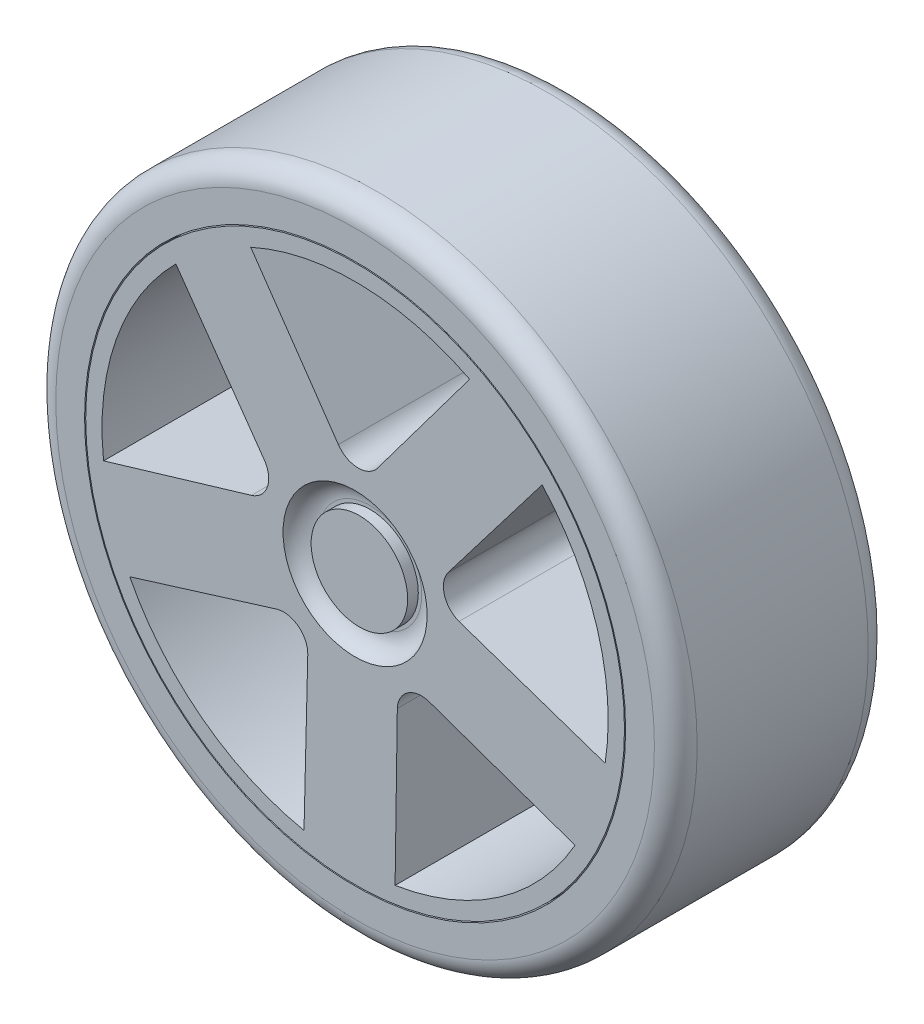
SolidWorks part; units mm, degrees
ref_plane "Front Plane" through (0, 0, 0) normal (0, 0, 1) x (1, 0, 0)
ref_plane "Top Plane" through (0, 0, 0) normal (0, 1, 0) x (1, 0, 0)
ref_plane "Right Plane" through (0, 0, 0) normal (1, 0, 0) x (0, 0, -1)
sketch "Sketch2" plane through (0, 0, 0) normal (0, 0, 1) x (1, 0, 0)
  circle A0 centre (0, 0) radius 38.1
  dimension "D1" = 76.2
extrude "Boss-Extrude1" add sketch "Sketch2" along normal blind 25.4
fillet "Fillet1" radius 2.54 2 edges at (38.1, 0, 0) (38.1, 0, 25.4)
sketch "Sketch3" plane through (0, 0, 25.4) normal (0, 0, 1) x (1, 0, 0)
  circle A0 centre (0, 0) radius 32.1386
extrude "Cut-Extrude1" cut sketch "Sketch3" against normal blind 25.4
sketch "Sketch4" plane through (0, 0, 0) normal (0, 0, 1) x (1, 0, 0)
  circle A0 centre (0, 0) radius 32.1386
sketch "Sketch6" plane through (0, 0, 0) normal (0, 0, 1) x (1, 0, 0)
  circle A0 centre (0, 0) radius 32.004
  dimension "D1" = 64.008
extrude "Boss-Extrude3" add sketch "Sketch6" along normal blind 25.4 separate body
sketch "Sketch7" plane through (0, 0, 25.4) normal (0, 0, 1) x (1, 0, 0)
  line L0 (-12.399, 27.3907) -> (-1.986, 12.2961)
  line L1 (2.6156, 12.1323) -> (13.6069, 26.8112)
  line L2 (12.3468, 1.2615) -> (29.7037, -4.6559)
  line L3 (22.2186, 20.2563) -> (11.0806, 5.6885)
  line L4 (5.0152, -11.3526) -> (4.751, -29.6886)
  line L5 (26.1309, -14.8716) -> (8.8342, -8.7804)
  line L6 (-9.2472, -8.2779) -> (-26.7674, -13.6927)
  line L7 (-6.0689, -29.4475) -> (-5.6208, -11.1151)
  line L8 (-10.7303, 6.2367) -> (-21.2942, 21.2261)
  line L9 (-29.8816, -3.3279) -> (-12.308, 1.9109)
  arc A0 (13.6069, 26.8112) -> (-12.399, 27.3907) centre (0, 0) ccw
  arc A5 (-1.986, 12.2961) -> (2.6156, 12.1323) centre (0.3757, 13.9253) ccw
  arc A6 (29.7037, -4.6559) -> (22.2186, 20.2563) centre (0, 0) ccw
  arc A7 (11.0806, 5.6885) -> (12.3468, 1.2615) centre (13.3599, 3.9458) ccw
  arc A8 (4.751, -29.6886) -> (26.1309, -14.8716) centre (0, 0) ccw
  arc A9 (8.8342, -8.7804) -> (5.0152, -11.3526) centre (7.8811, -11.4866) ccw
  arc A10 (-26.7674, -13.6927) -> (-6.0689, -29.4475) centre (0, 0) ccw
  arc A11 (-5.6208, -11.1151) -> (-9.2472, -8.2779) centre (-8.489, -11.045) ccw
  arc A12 (-21.2942, 21.2261) -> (-29.8816, -3.3279) centre (0, 0) ccw
  arc A13 (-12.308, 1.9109) -> (-10.7303, 6.2367) centre (-13.1277, 4.6605) ccw
  point P29 (0, 0)
  point P30 (0, 0)
  dimension "D1" = 5
extrude "Cut-Extrude4" cut sketch "Sketch7" against normal blind 25.4
sketch "Sketch9" plane through (0, 0, 25.4) normal (0, 0, 1) x (1, 0, 0)
  circle A0 centre (0, 0) radius 8.5594
extrude "Cut-Extrude5" cut sketch "Sketch9" against normal blind 1.778
fillet "Fillet2" radius 2.54 1 edges at (8.5594, 0, 23.622)
sketch "Sketch10" plane through (0, 0, 23.622) normal (0, 0, 1) x (1, 0, 0)
  circle A0 centre (0, 0) radius 5.7316
extrude "Boss-Extrude4" add sketch "Sketch10" along normal blind 1.27
sketch "Sketch11" plane through (0, 0, 0) normal (0, 0, -1) x (-1, 0, 0)
  circle A0 centre (0, 0) radius 1.778
  dimension "D1" = 3.556
extrude "Cut-Extrude6" cut sketch "Sketch11" against normal blind 3.81
